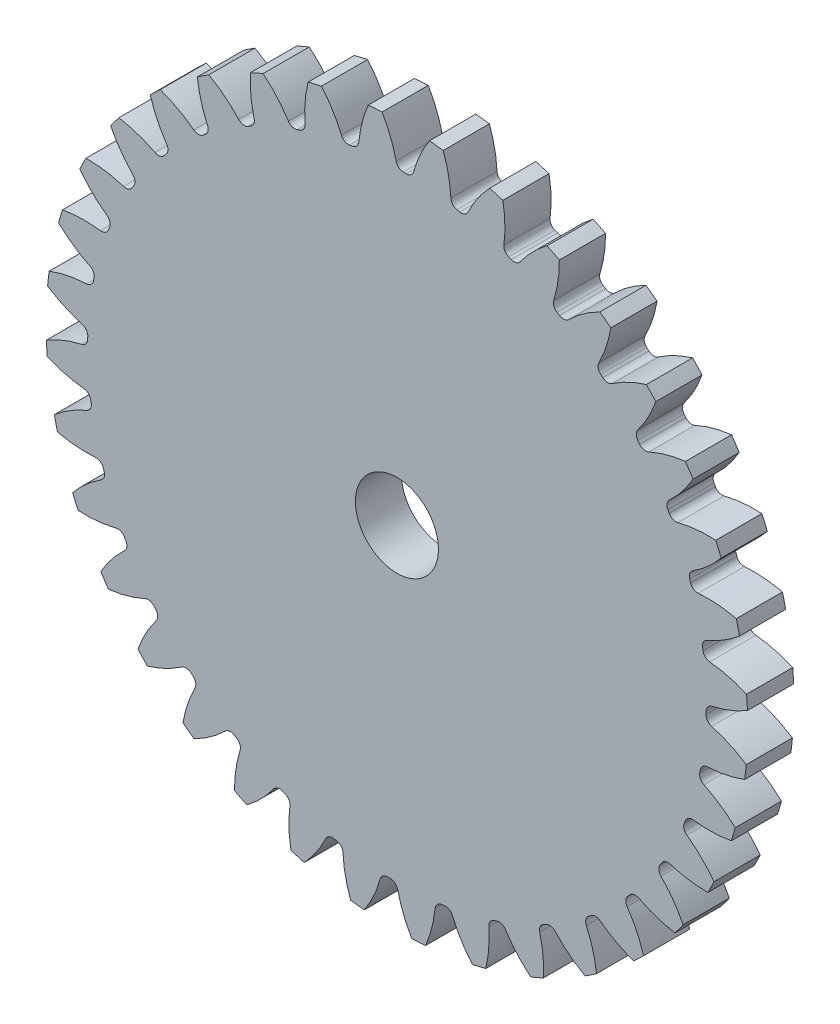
SolidWorks part; units mm, degrees
ref_plane "Front" through (0, 0, 0) normal (0, 0, 1) x (1, 0, 0)
ref_plane "Top" through (0, 0, 0) normal (0, 1, 0) x (1, 0, 0)
ref_plane "Right" through (0, 0, 0) normal (1, 0, 0) x (0, 0, -1)
sketch "Sketch3" plane through (0, 0, 0) normal (0, 0, 1) x (1, 0, 0)
  circle A0 centre (0, 0) radius 965.2
  dimension "od" = 1930.4
extrude "gearBody" add sketch "Sketch3" along normal blind 127
sketch "Sketch2" plane through (0, 0, 0) normal (0, 0, 1) x (1, 0, 0)
  line L0 (0, 0) -> (793.848, 328.8226) construction
  line L1 (961.8709, -90.1096) -> (0, 0) construction
  line L2 (0, 0) -> (36.3143, 0) construction
  line L3 (914.2511, 16.5036) -> (912.2422, -62.7811) construction
  line L5 (913.2466, -23.1387) -> (0, 0) construction
  line L7 (0, 0) -> (859.2549, 0) construction
  arc A0 (859.2548, 0.5514) -> (858.1243, -44.0642) centre (0, 0) ccw construction
  arc A1 (964.3385, 40.7722) -> (961.0364, -89.555) centre (0, 0) ccw construction
  arc A2 (914.2511, 16.5036) -> (912.2422, -62.7811) centre (0, 0) ccw construction
  arc A3 (850.5173, -25.5165) -> (850.7182, -17.5873) centre (0, 0) ccw
  arc A4 (961.8709, -90.1096) -> (865.6566, -46.0597) centre (776.1776, -368.602) ccw
  arc A5 (961.8709, -90.1096) -> (965.2, 41.2839) centre (0, 0) ccw
  arc A6 (965.2, 41.2839) -> (866.8784, 2.1629) centre (793.848, 328.8226) cw
  arc A7 (850.7182, -17.5873) -> (866.8784, 2.1629) centre (871.3894, -18.0146) cw
  arc A8 (865.6566, -46.0597) -> (850.5173, -25.5165) centre (871.1836, -26.1365) cw
  point P6 (965.2, 41.2839)
  point P22 (961.8709, -90.1096)
  dimension "baseDia" = 1718.5099
  dimension "od" = 1930.4
  dimension "pd" = 1828.8
  dimension "rd" = 1701.8
  dimension "rFillet" = 20.6756
  dimension "pointX" = 965.2
  dimension "pointY" = 41.2839
  dimension "CTT" = 79.2847
  dimension "flankCenterAngle" = 22.5
extrude "toothCut" cut sketch "Sketch2" along normal through all
pattern_circular "CirPattern1" count 36 over 360 about axis through (0, 0, 0) along (0, 0, 1) of "toothCut"
sketch "hub1Dia" plane through (0, 0, 0) normal (0, 0, -1) x (-1, 0, 0)
  circle A0 centre (0, 0) radius 12.7
  dimension "hub1Dia" = 25.4
sketch "hub2Dia" plane through (0, 0, 127) normal (0, 0, 1) x (1, 0, 0)
  circle A0 centre (0, 0) radius 12.7
  dimension "hub2dia" = 25.4
sketch "boreDia" plane through (0, 0, 0) normal (0, 0, 1) x (1, 0, 0)
  circle A0 centre (0, 0) radius 114.3
  dimension "boreDia" = 228.6
extrude "bore" cut sketch "boreDia" against normal mid plane 25400
